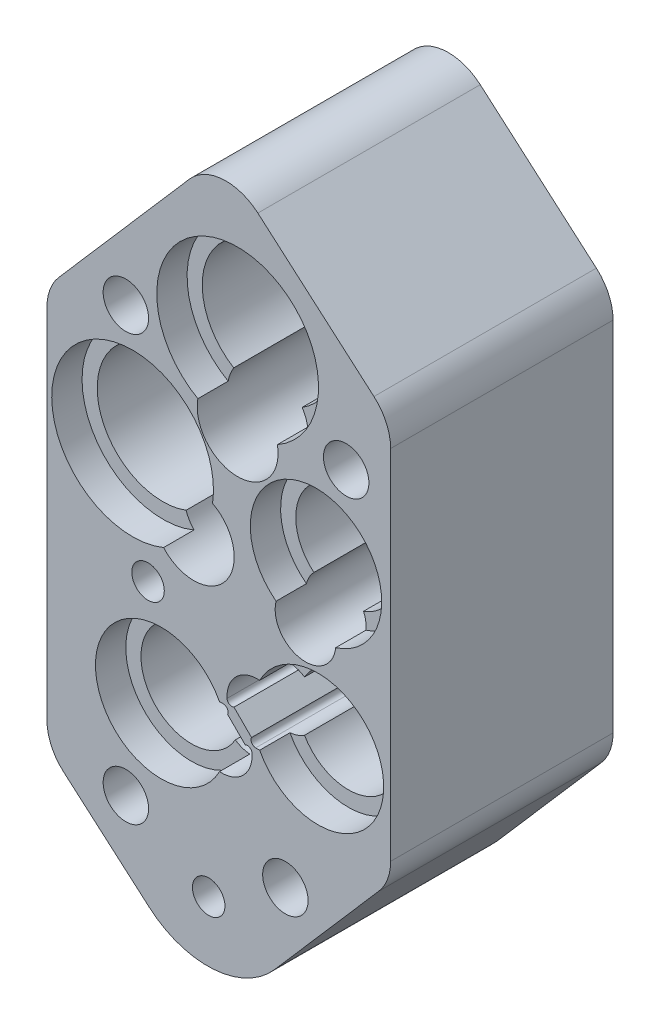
SolidWorks part; units mm, degrees
ref_plane "Front" through (0, 0, 0) normal (0, 0, 1) x (1, 0, 0)
ref_plane "Top" through (0, 0, 0) normal (0, 1, 0) x (1, 0, 0)
ref_plane "Right" through (0, 0, 0) normal (1, 0, 0) x (0, 0, -1)
ref_plane "Plane1"
sketch "Sketch1" plane through (0, 0, 40.2082) normal (0, 0, -1) x (-1, 0, 0)
  line L0 (827.6942, -72.3181) -> (833.0797, -67.6412) construction
  line L1 (827.6942, -72.3181) -> (833.0797, -67.6412) construction
  line L3 (778.4666, 11.1437) -> (796.6984, 26.9766)
  line L4 (777.7097, -55.7498) -> (794.0493, -74.565)
  line L5 (807.4481, 26.2197) -> (827.9513, 2.6101)
  line L6 (813.757, -75.9528) -> (827.1944, -64.2834)
  line L8 (775.843, 5.3903) -> (775.843, -50.7535)
  line L9 (829.818, -2.3863) -> (829.818, -58.5301)
  line L12 (777.367, 0) -> (817.118, 0) construction
  line L13 (817.118, -85.471) -> (817.118, 85.471) construction
  arc A0 (794.0493, -74.565) -> (813.757, -75.9528) centre (804.5971, -65.405) ccw
  arc A1 (829.818, -2.3863) -> (827.9513, 2.6101) centre (822.198, -2.3863) ccw
  arc A2 (775.843, -50.7535) -> (777.7097, -55.7498) centre (783.463, -50.7535) ccw
  arc A3 (796.6984, 26.9766) -> (807.4481, 26.2197) centre (801.6947, 21.2233) cw
  arc A4 (775.843, 5.3903) -> (778.4666, 11.1437) centre (783.463, 5.3903) cw
  arc A5 (827.1944, -64.2834) -> (829.818, -58.5301) centre (822.198, -58.5301) ccw
extrude "Boss-Extrude1" add sketch "Sketch1" against normal blind 31.75 and the other way blind 3.175 flip side to cut
hole_wizard "Hole1" positions "Point_Sketch" profile "Profil_Sketch" hole size "Ø0.15" standard "ISO"
sketch "Point_Sketch" plane through (-806.009, -36.6401, 71.9582) normal (0, 0, -1) x (1, 0, 0)
  point P0 (3.6543, 10.6011)
  point P2 (9.231, 4.5369)
sketch "Profil_Sketch" plane through (-802.3548, -47.2413, 71.9582) normal (1, 0, 0) x (0, -1, 0)
  line L0 (0, 0) -> (0, 34.925)
  line L1 (0, 34.925) -> (4.7625, 34.925)
  line L2 (4.7625, 34.925) -> (4.7625, 0)
  line L5 (4.7625, 0) -> (0, 0)
  line L11 (0, -6.35) -> (0, 107.95) construction
  dimension "Diameter" = 9.525
  dimension "Thru Hole Depth" = 34.925
other "usin_DL090<1>"
hole_wizard "Hole11" positions "Point_Sketch1" profile "Profil_Sketch1" hole size "Ø0.15" standard "ISO"
sketch "Point_Sketch1" plane through (-792.875, -14.9521, 71.9582) normal (0, 0, -1) x (1, 0, 0)
  point P0 (3.6543, 10.6011)
sketch "Profil_Sketch1" plane through (-789.2208, -25.5532, 71.9582) normal (1, 0, 0) x (0, -1, 0)
  line L0 (0, 0) -> (0, 34.925)
  line L1 (0, 34.925) -> (4.7625, 34.925)
  line L2 (4.7625, 34.925) -> (4.7625, 0)
  line L5 (4.7625, 0) -> (0, 0)
  line L11 (0, -6.35) -> (0, 107.95) construction
  dimension "Diameter" = 9.525
  dimension "Thru Hole Depth" = 34.925
other "usin_DL090<2>"
hole_wizard "Hole12" positions "Point_Sketch2" profile "Profil_Sketch2" hole size "Ø0.15" standard "ISO"
sketch "Point_Sketch2" plane through (-810.4146, -11.0849, 71.9582) normal (0, 0, -1) x (1, 0, 0)
  point P0 (3.6543, 10.6011)
sketch "Profil_Sketch2" plane through (-806.7604, -21.6861, 71.9582) normal (1, 0, 0) x (0, -1, 0)
  line L0 (0, 0) -> (0, 34.925)
  line L1 (0, 34.925) -> (6.35, 34.925)
  line L2 (6.35, 34.925) -> (6.35, 0)
  line L5 (6.35, 0) -> (0, 0)
  line L11 (0, -6.35) -> (0, 107.95) construction
  dimension "Diameter" = 12.7
  dimension "Thru Hole Depth" = 34.925
other "usin_DL090<3>"
hole_wizard "Hole13" positions "Point_Sketch3" profile "Profil_Sketch3" counterbore size "1/4" standard "ANSI Inch"
sketch "Point_Sketch3" plane through (-812.7423, -3.1747, 71.9582) normal (0, 0, -1) x (1, 0, 0)
  point P0 (12.8691, 0.935)
sketch "Profil_Sketch3" plane through (-799.8731, -4.1097, 71.9582) normal (1, 0, 0) x (0, -1, 0)
  line L0 (0, 0) -> (0, 34.925)
  line L1 (0, 34.925) -> (6.35, 34.925)
  line L3 (6.35, 34.925) -> (6.35, 0)
  line L4 (6.35, 4.7752) -> (1.27, 4.7752) construction
  line L5 (1.27, 4.7752) -> (1.27, 0) construction
  line L7 (6.35, 0) -> (0, 0)
  line L11 (0, -6.35) -> (0, 107.95) construction
  dimension "Diameter" = 12.7
  dimension "Thru Hole Depth" = 34.925
  dimension "L1" = 4.7752
other "usin_LS160_DAYTON VERSATILE INCH VPO-50-2130-P0.1999-W0.1310 X2-0<1>"
hole_wizard "Hole14" positions "Point_Sketch4" profile "Profil_Sketch4" counterbore size "1/4" standard "ANSI Inch"
sketch "Point_Sketch4" plane through (-800.1221, -40.242, 71.9582) normal (0, 0, -1) x (1, 0, 0)
  point P0 (12.8691, 0.935)
  point P2 (-11.7577, 6.9993)
  point P4 (12.5553, -24.0691)
sketch "Profil_Sketch4" plane through (-787.253, -41.177, 71.9582) normal (1, 0, 0) x (0, -1, 0)
  line L0 (0, 0) -> (0, 34.925)
  line L1 (0, 34.925) -> (7.9375, 34.925)
  line L3 (7.9375, 34.925) -> (7.9375, 4.7625)
  line L4 (7.9375, 4.7625) -> (10.3187, 4.7625)
  line L5 (10.3187, 4.7625) -> (10.3187, 0)
  line L7 (10.3187, 0) -> (0, 0)
  line L11 (0, -6.35) -> (0, 107.95) construction
  dimension "Diameter" = 15.875
  dimension "Thru Hole Depth" = 34.925
  dimension "L1" = 4.7625
other "usin_LS160<2>"
hole_wizard "Hole15" positions "Point_Sketch5" profile "Profil_Sketch5" counterbore size "1/4" standard "ANSI Inch"
sketch "Point_Sketch5" plane through (-812.7423, 9.0173, 71.9582) normal (0, 0, -1) x (1, 0, 0)
  point P0 (12.8691, 0.935)
  point P2 (-3.6256, 23.1972)
sketch "Profil_Sketch5" plane through (-799.8731, 8.0823, 71.9582) normal (1, 0, 0) x (0, -1, 0)
  line L0 (0, 0) -> (0, 34.925)
  line L1 (0, 34.925) -> (10.3187, 34.925)
  line L3 (10.3187, 34.925) -> (10.3188, 4.7625)
  line L4 (10.3188, 4.7625) -> (12.7, 4.7625)
  line L5 (12.7, 4.7625) -> (12.7, 0)
  line L7 (12.7, 0) -> (0, 0)
  line L11 (0, -6.35) -> (0, 107.95) construction
  dimension "Diameter" = 20.6375
  dimension "Thru Hole Depth" = 34.925
  dimension "L1" = 4.7625
other "usin_LS160<3>"
hole_wizard "Hole16" positions "Point_Sketch6" profile "Profil_Sketch6" counterbore size "1/4" standard "ANSI Inch"
sketch "Point_Sketch6" plane through (-771.2289, 0.3767, 37.0332) normal (0, 0, 1) x (-1, 0, 0)
  point P0 (11.5991, 1.3784)
  point P2 (46.1961, -3.7016)
  point P4 (21.1493, 62.9734)
  point P6 (46.1961, 62.9734)
sketch "Profil_Sketch6" plane through (-782.828, -1.0017, 37.0332) normal (1, 0, 0) x (0, 1, 0)
  line L0 (0, 0) -> (0, 34.925)
  line L1 (0, 34.925) -> (3.5687, 34.925)
  line L3 (3.5687, 34.925) -> (3.5687, 14.224)
  line L4 (3.5687, 14.224) -> (5.3594, 14.224)
  line L5 (5.3594, 14.224) -> (5.3594, 0)
  line L7 (5.3594, 0) -> (0, 0)
  line L11 (0, -6.35) -> (0, 107.95) construction
  dimension "Diameter" = 7.1374
  dimension "Thru Hole Depth" = 34.925
  dimension "L1" = 14.224
other "usin_LS160_.25-20x1.75-SHCS<4>"
sketch "Sketch2" plane through (0, 0, 71.9582) normal (0, 0, 1) x (1, 0, 0)
  line L0 (-797.5957, -47.4205) -> (-802.534, -42.4821) construction
  line L1 (-801.5371, -40.9978) -> (-796.5988, -45.9361) construction
  line L2 (-797.5957, -47.4205) -> (-802.534, -42.4821)
  line L3 (-801.5371, -40.9978) -> (-796.5988, -45.9361)
  arc A0 (-802.534, -42.4821) -> (-797.5957, -47.4205) centre (-802.3548, -47.2413) ccw construction
  arc A1 (-796.5988, -45.9361) -> (-801.5371, -40.9978) centre (-796.778, -41.177) ccw construction
  arc A2 (-802.534, -42.4821) -> (-797.5957, -47.4205) centre (-802.3548, -47.2413) ccw
  arc A3 (-796.5988, -45.9361) -> (-801.5371, -40.9978) centre (-796.778, -41.177) ccw
sketch "Sketch3" plane through (0, 0, 71.9582) normal (0, 0, 1) x (1, 0, 0)
  line L1 (-801.5371, -40.9978) -> (-796.5988, -45.9361)
  line L2 (-800.4437, -42.0912) -> (-797.6923, -44.8427)
  line L3 (-797.5957, -47.4205) -> (-802.534, -42.4821)
  line L4 (-798.6891, -46.327) -> (-801.4405, -43.5756)
  arc A1 (-796.5988, -45.9361) -> (-801.5371, -40.9978) centre (-796.778, -41.177) ccw
  arc A2 (-801.5329, -41.4468) -> (-801.3257, -42.5913) centre (-796.778, -41.177) ccw
  arc A3 (-802.534, -42.4821) -> (-797.5957, -47.4205) centre (-802.3548, -47.2413) ccw
  arc A4 (-801.3257, -42.5913) -> (-802.085, -42.4864) centre (-802.3548, -47.2413) ccw
  arc A5 (-801.4405, -43.5756) -> (-802.085, -42.4864) centre (-802.1281, -43.2472) ccw
  arc A6 (-797.5999, -46.9714) -> (-798.6891, -46.327) centre (-798.3607, -47.0146) ccw
  arc A7 (-797.6923, -44.8427) -> (-797.0478, -45.9318) centre (-797.0046, -45.1711) ccw
  arc A8 (-801.5329, -41.4468) -> (-800.4437, -42.0912) centre (-800.7721, -41.4036) ccw
  arc A9 (-797.5999, -46.9714) -> (-797.8071, -45.827) centre (-802.3548, -47.2413) ccw
  arc A10 (-797.8071, -45.827) -> (-797.0478, -45.9318) centre (-796.778, -41.177) ccw
  dimension "D3" = 0.762
  dimension "D4" = 0.254
  dimension "D5" = 0.254
  dimension "D7" = 0.254
  dimension "D6" = 0.254
  dimension "D1" = 0
  dimension "D2" = 0
extrude "Boss-Extrude2" add sketch "Sketch3" against normal up to surface (34.925 mm away)
hole_wizard "Hole17" positions "Point_Sketch7" profile "Profil_Sketch7" tap size "1/4-20" standard "ANSI Inch"
sketch "Point_Sketch7" plane through (-818.6315, -60.6786, 71.9582) normal (0, 0, 1) x (1, 0, 0)
  point P0 (14.2135, -9.1678)
  point P2 (4.6885, 28.9286)
sketch "Profil_Sketch7" plane through (-804.418, -69.8464, 71.9582) normal (1, 0, 0) x (0, -1, 0)
  line L0 (0, 0) -> (0, 36.4588)
  line L1 (0, 36.4588) -> (2.5527, 34.925)
  line L2 (2.5527, 34.925) -> (2.5527, 0)
  line L5 (2.5527, 0) -> (0, 0)
  line L10 (0, 36.4588) -> (-2.5527, 34.925) construction
  line L11 (0, -6.35) -> (0, 107.95) construction
  dimension "Tap Drill Dia." = 5.1054
  dimension "Tap Drill Depth" = 34.925
  dimension "Drill Angle" = 118
other "usin_DT360_.25-20x.625-SHCS<1>"
